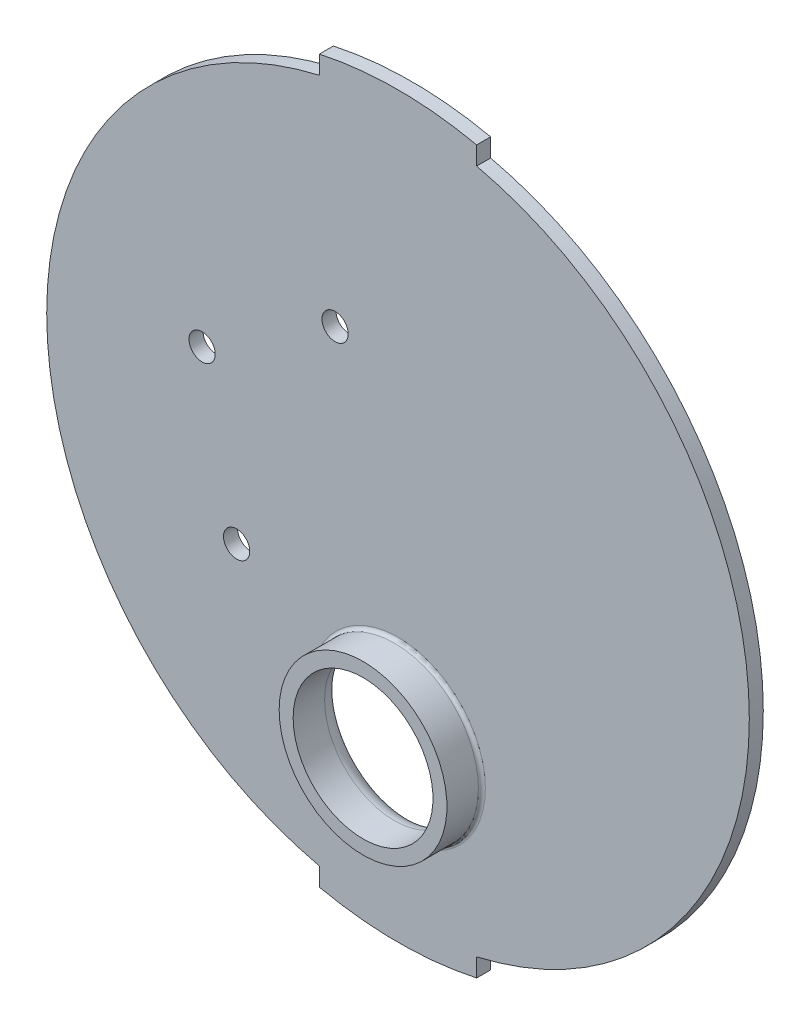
SolidWorks part; units mm, degrees
ref_plane "Face" through (0, 0, 0) normal (0, 0, 1) x (1, 0, 0)
ref_plane "Dessus" through (0, 0, 0) normal (0, 1, 0) x (1, 0, 0)
ref_plane "Droite" through (0, 0, 0) normal (1, 0, 0) x (0, 0, -1)
sketch "Esquisse1" plane through (0, 0, 0) normal (0, 0, 1) x (1, 0, 0)
  circle A0 centre (0, 11) radius 20.1
  circle A3 centre (0, 11) radius 20.1 construction
  circle A4 centre (0, 0) radius 4
  point P4 (-6.6974, 3.5035)
  dimension "D1" = 8
extrude "Boss.-Extru.1" add sketch "Esquisse1" along normal blind 0.8
sketch "Esquisse2" plane through (0, 0, 0.8) normal (0, 0, 1) x (1, 0, 0)
  circle A0 centre (-3.6, 18.5895) radius 0.75 construction
  circle A1 centre (-11.2076, 13.7807) radius 0.75 construction
  circle A2 centre (-9.2331, 5) radius 0.75 construction
  circle A3 centre (-3.6, 18.5895) radius 0.75
  circle A4 centre (-11.2076, 13.7807) radius 0.75
  circle A5 centre (-9.2331, 5) radius 0.75
extrude "Enlèv. mat.-Extru.1" cut sketch "Esquisse2" against normal through all
sketch "Esquisse3" plane through (0, 0, 0.8) normal (0, 0, -1) x (-1, 0, 0)
  circle A0 centre (0, 0) radius 4 construction
  circle A1 centre (0, 0) radius 4
  circle A2 centre (0, 0) radius 4.8
  dimension "D1" = 0.8
extrude "Boss.-Extru.2" add sketch "Esquisse3" against normal blind 2
fillet "Congé1" radius 1 1 edges at (4, 0, 0)
fillet "Congé2" radius 0.2 1 edges at (4.8, 0, 0.8)
sketch "Esquisse4" plane through (0, 0, 0.8) normal (0, 0, 1) x (1, 0, 0)
  line L0 (4.5, 31.6401) -> (4.5, 30.5898) construction
  line L1 (-4.5, 30.5898) -> (-4.5, 31.6401) construction
  line L4 (4.5, -8.5898) -> (4.5, -9.6401) construction
  line L5 (-4.5, -8.5898) -> (-4.5, -9.6401) construction
  line L6 (4.5, -8.5898) -> (4.5, -9.6401)
  line L7 (-4.5, -8.5898) -> (-4.5, -9.6401)
  line L8 (4.5, 31.6401) -> (4.5, 30.5898)
  line L9 (-4.5, 30.5898) -> (-4.5, 31.6401)
  circle A0 centre (0, 11) radius 20.1 construction
  arc A1 (-4.5, -8.5898) -> (4.5, -8.5898) centre (0, 11) ccw
  arc A2 (-4.5, -9.6401) -> (4.5, -9.6401) centre (0, 11) ccw construction
  arc A3 (-4.5, -9.6401) -> (4.5, -9.6401) centre (0, 11) ccw
  arc A4 (4.5, 31.6401) -> (-4.5, 31.6401) centre (0, 11) ccw construction
  arc A5 (4.5, 31.6401) -> (-4.5, 31.6401) centre (0, 11) ccw
  arc A6 (4.5, 30.5898) -> (-4.5, 30.5898) centre (0, 11) ccw
extrude "Boss.-Extru.3" add sketch "Esquisse4" against normal up to surface (0.8 mm away)
